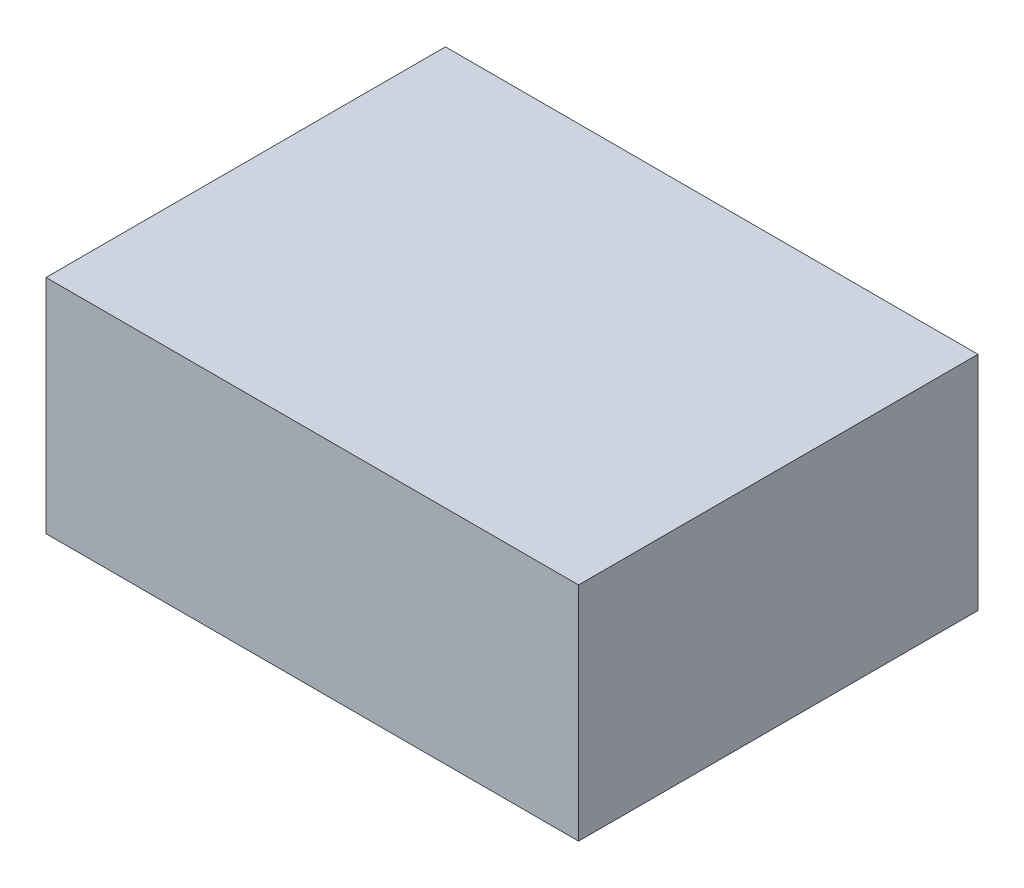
SolidWorks part; units mm, degrees
ref_plane "Front Plane" through (0, 0, 0) normal (0, 0, 1) x (1, 0, 0)
ref_plane "Top Plane" through (0, 0, 0) normal (0, 1, 0) x (1, 0, 0)
ref_plane "Right Plane" through (0, 0, 0) normal (1, 0, 0) x (0, 0, -1)
sketch "Sketch1" plane through (0, 0, 0) normal (0, 1, 0) x (1, 0, 0)
  line L1 (-152.4, 114.3) -> (152.4, 114.3)
  line L2 (-152.4, 114.3) -> (-152.4, -114.3)
  line L3 (-152.4, -114.3) -> (152.4, -114.3)
  line L4 (152.4, 114.3) -> (152.4, -114.3)
  line L5 (-152.4, 114.3) -> (152.4, -114.3) construction
  line L6 (-152.4, -114.3) -> (152.4, 114.3) construction
  point P0 (0, 0)
  dimension "D1" = 304.8
  dimension "D2" = 228.6
extrude "Boss-Extrude1" add sketch "Sketch1" along normal blind 127
